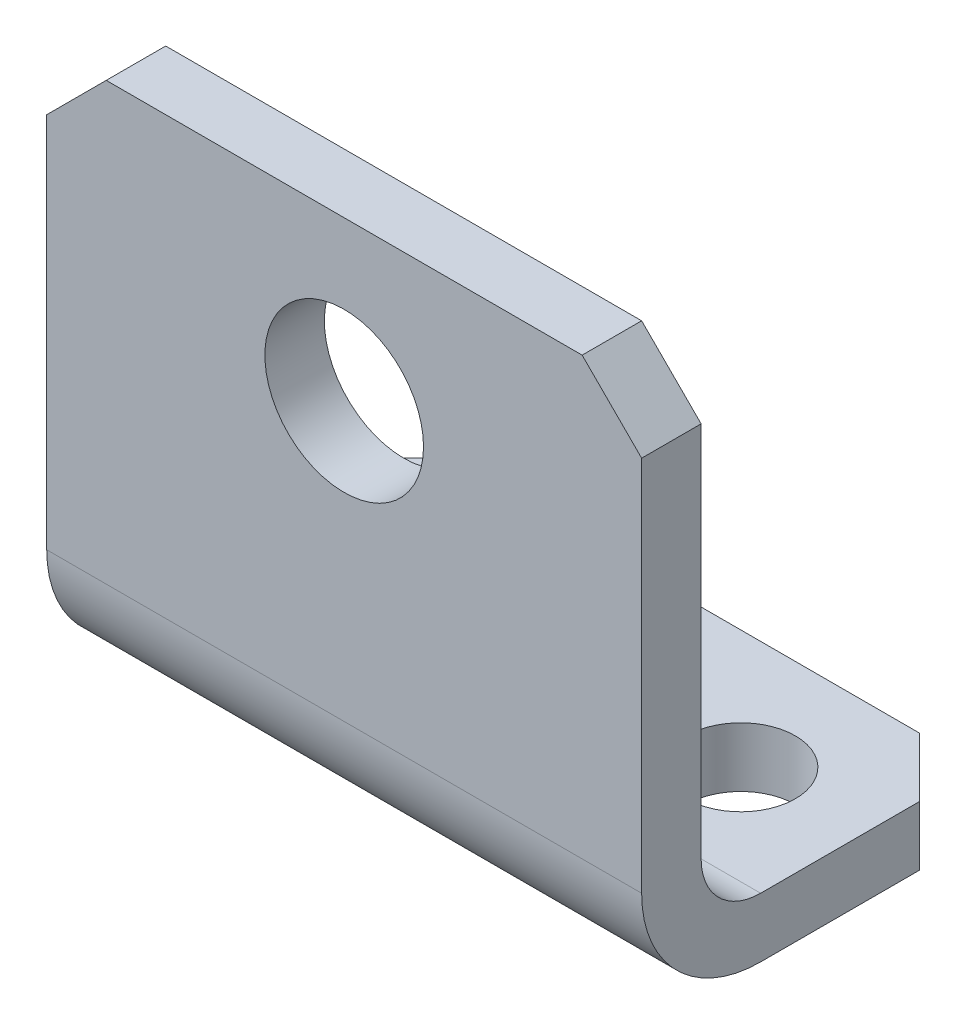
SolidWorks part; units mm, degrees
ref_plane "Спереди" through (0, 0, 0) normal (0, 0, 1) x (1, 0, 0)
ref_plane "Сверху" through (0, 0, 0) normal (0, 1, 0) x (1, 0, 0)
ref_plane "Справа" through (0, 0, 0) normal (1, 0, 0) x (0, 0, -1)
sketch "Эскиз1" plane through (0, 0, 0) normal (1, 0, 0) x (0, 0, -1)
  line L0 (0, 0) -> (3, 0)
  line L1 (3, 0) -> (3, -22)
  line L2 (6, -25) -> (17, -25)
  line L3 (17, -25) -> (17, -28)
  line L4 (17, -28) -> (6, -28)
  line L5 (0, -22) -> (0, 0)
  arc A0 (3, -22) -> (6, -25) centre (6, -22) ccw
  arc A1 (6, -28) -> (0, -22) centre (6, -22) cw
  point P11 (0, -28)
  dimension "D5" = 3
  dimension "D6" = 6
  dimension "D1" = 3
  dimension "D2" = 3
  dimension "D3" = 28
  dimension "D4" = 17
extrude "Бобышка-Вытянуть1" add sketch "Эскиз1" along normal blind 30
sketch "Эскиз2" plane through (0, 0, 0) normal (0, 0, 1) x (1, 0, 0)
  line L0 (30, 0) -> (0, 0) construction
  line L1 (30, 0) -> (30, -22) construction
  circle A0 centre (15, -8) radius 4
  dimension "D1" = 8
  dimension "D2" = 8
  dimension "D3" = 15
extrude "Вырез-Вытянуть1" cut sketch "Эскиз2" against normal blind 10
sketch "Эскиз3" plane through (0, -28, 0) normal (0, -1, 0) x (1, 0, 0)
  line L0 (30, -17) -> (0, -17) construction
  line L1 (30, -6) -> (30, -17) construction
  circle A0 centre (6, -11) radius 2.75
  circle A1 centre (24, -11) radius 2.75
  dimension "D1" = 5.5
  dimension "D2" = 5.5
  dimension "D3" = 6
  dimension "D4" = 6
  dimension "D5" = 18
  dimension "D6" = 6
extrude "Вырез-Вытянуть2" cut sketch "Эскиз3" against normal blind 10
chamfer "Фаска2" distance 3 angle 45 4 edges at (30, -26.5, -17) (0, -26.5, -17) (0, 0, -1.5) (30, 0, -1.5)
